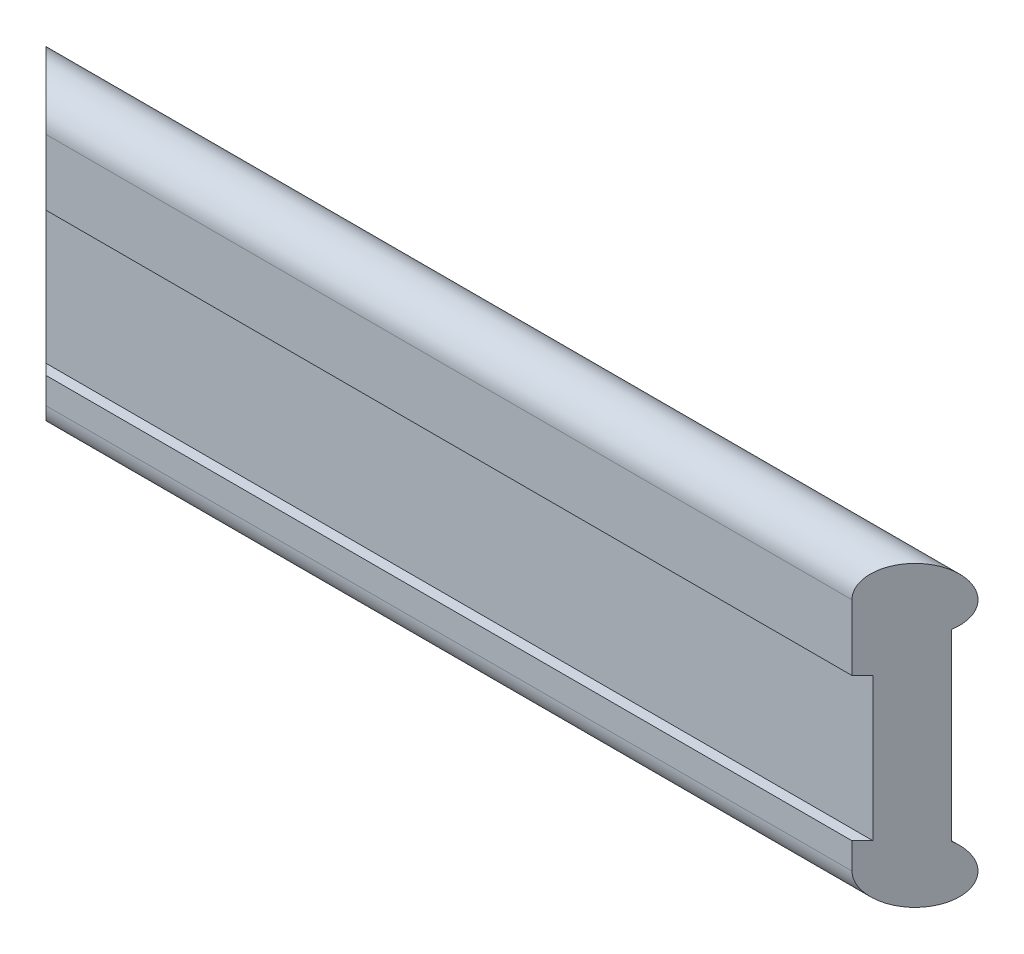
SolidWorks part; units mm, degrees
ref_plane "Front Plane" through (0, 0, 0) normal (0, 0, 1) x (1, 0, 0)
ref_plane "Top Plane" through (0, 0, 0) normal (0, 1, 0) x (1, 0, 0)
ref_plane "Right Plane" through (0, 0, 0) normal (1, 0, 0) x (0, 0, -1)
sketch "Sketch1" plane through (0, 0, 0) normal (0, 0, 1) x (1, 0, 0)
  line L1 (-177.5, -27.25) -> (177.5, -27.25)
  line L2 (-177.5, -27.25) -> (-177.5, 27.25)
  line L3 (-177.5, 27.25) -> (177.5, 27.25)
  line L4 (177.5, -27.25) -> (177.5, 27.25)
  line L5 (-177.5, -27.25) -> (177.5, 27.25) construction
  line L6 (-177.5, 27.25) -> (177.5, -27.25) construction
  point P0 (0, 0)
  dimension "D1" = 355
  dimension "D2" = 54.5
extrude "Boss-Extrude1" add sketch "Sketch1" along normal blind 15
sketch "Sketch2" plane through (-177.5, 0, 0) normal (-1, 0, 0) x (0, 0, 1)
  line L0 (15, 27.25) -> (19, 27.25)
  line L1 (19, 27.25) -> (19, 52.25)
  line L2 (0, 42.5032) -> (0, 27.25)
  line L3 (0, 27.25) -> (15, 27.25)
  line L4 (0, -27.25) -> (15, -27.25)
  line L5 (15, -27.25) -> (19, -27.25)
  line L6 (19, -27.25) -> (19, -37.25)
  line L7 (0, -27.5032) -> (0, -27.25)
  arc A0 (19, 52.25) -> (0, 42.5032) centre (7, 52.25) ccw
  arc A1 (19, -37.25) -> (0, -27.5032) centre (7, -37.25) cw
  dimension "D3" = 12
  dimension "D5" = 12
  dimension "D1" = 4
  dimension "D2" = 25
  dimension "D4" = 10
extrude "Boss-Extrude2" add sketch "Sketch2" against normal up to surface (355 mm away)
sketch "Sketch3" plane through (0, 0, 0) normal (0, 1, 0) x (1, 0, 0)
  line L0 (-177.5, 5) -> (-153.5, -19)
  line L1 (177.5, -19) -> (-177.5, -19) construction
  line L2 (-153.5, -19) -> (0, -19)
  line L3 (0, -19) -> (153.5, -19)
  line L4 (153.5, -19) -> (177.5, 5)
  line L5 (177.5, 5) -> (177.5, -29)
  line L6 (177.5, -29) -> (-177.5, -29)
  line L7 (-177.5, -29) -> (-177.5, 5)
  dimension "D1" = 45
  dimension "D2" = 10
extrude "Cut-Extrude1" cut sketch "Sketch3" against normal through all and the other way through all
